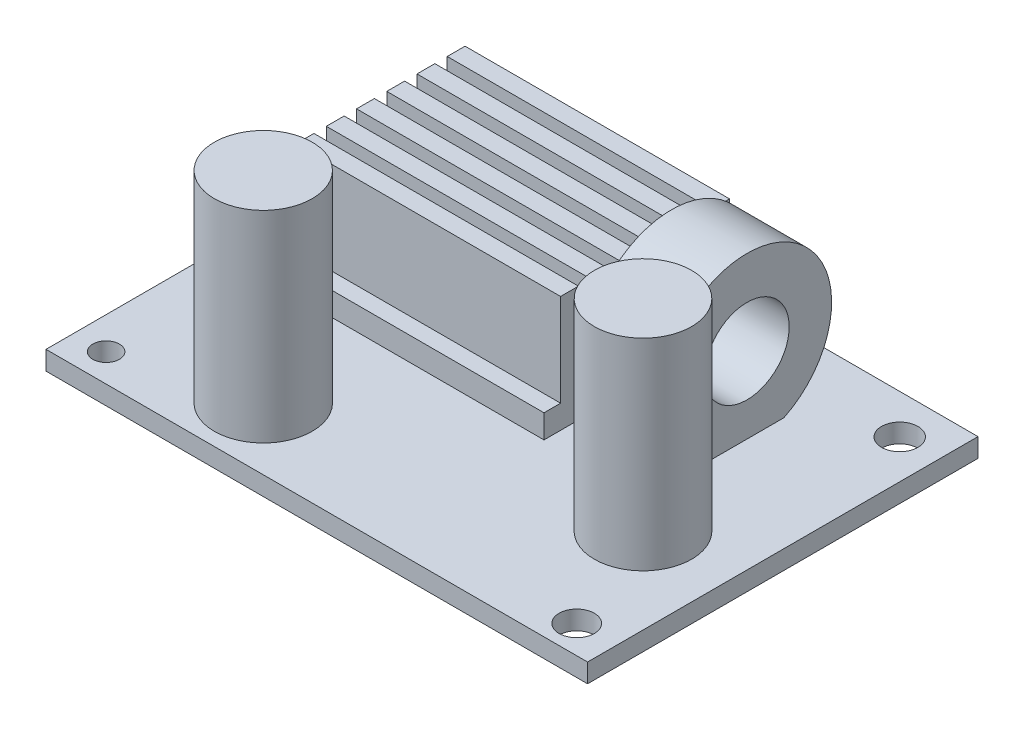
SolidWorks part; units mm, degrees
ref_plane "Plan de face" through (0, 0, 0) normal (0, 0, 1) x (1, 0, 0)
ref_plane "Plan de dessus" through (0, 0, 0) normal (0, 1, 0) x (1, 0, 0)
ref_plane "Plan de droite" through (0, 0, 0) normal (1, 0, 0) x (0, 0, -1)
sketch "Esquisse1" plane through (0, 0, 0) normal (0, 1, 0) x (1, 0, 0)
  line L0 (-21.5, 15.5) -> (21.5, -15.5) construction
  line L1 (-21.5, 15.5) -> (21.5, 15.5)
  line L2 (-21.5, 15.5) -> (-21.5, -15.5)
  line L3 (-21.5, -15.5) -> (21.5, -15.5)
  line L4 (21.5, 15.5) -> (21.5, -15.5)
  circle A0 centre (-18.9523, 12.8229) radius 1.3806
  circle A1 centre (-18.9523, -13.2741) radius 1.0529
  circle A2 centre (18.4125, -13.2741) radius 1.3969
  circle A3 centre (18.4125, 12.3716) radius 1.4447
  dimension "D1" = 31
  dimension "D2" = 43
extrude "Boss.-Extru.1" add sketch "Esquisse1" along normal blind 1.5
sketch "Esquisse2" plane through (0, 1.5, 0) normal (0, 1, 0) x (1, 0, 0)
  circle A0 centre (14.7016, -4.3011) radius 3.8652
  circle A1 centre (-9.1786, -10.5714) radius 3.8858
extrude "Boss.-Extru.2" add sketch "Esquisse2" along normal blind 16
sketch "Esquisse3" plane through (-21.5, 0, 0) normal (-1, 0, 0) x (0, 0, 1)
  line L0 (-12.7734, 1.5) -> (-12.7734, 10.7088)
  line L1 (-15.5, 1.5) -> (15.5, 1.5) construction
  line L2 (-12.7734, 10.7088) -> (-11.3578, 10.7088)
  line L3 (-11.3578, 10.7088) -> (-11.3578, 3.3674)
  line L4 (-11.3578, 3.3674) -> (-10.041, 3.3674)
  line L5 (-10.041, 3.3674) -> (-10.041, 1.5)
  line L6 (-10.041, 1.5) -> (-12.7734, 1.5)
extrude "Boss.-Extru.3" add sketch "Esquisse3" against normal blind 21 from offset 5
pattern_linear "Répétition linéaire1" count 6 spacing 2.4 along (0, 0, 1) of "Boss.-Extru.3"
sketch "Esquisse4" plane through (21.5, 0, 0) normal (1, 0, 0) x (0, 0, -1)
  circle A0 centre (6.1563, 7.5484) radius 6.7221
  circle A1 centre (6.1563, 7.5484) radius 3.3522
extrude "Boss.-Extru.4" add sketch "Esquisse4" along normal blind 6 from offset 15
